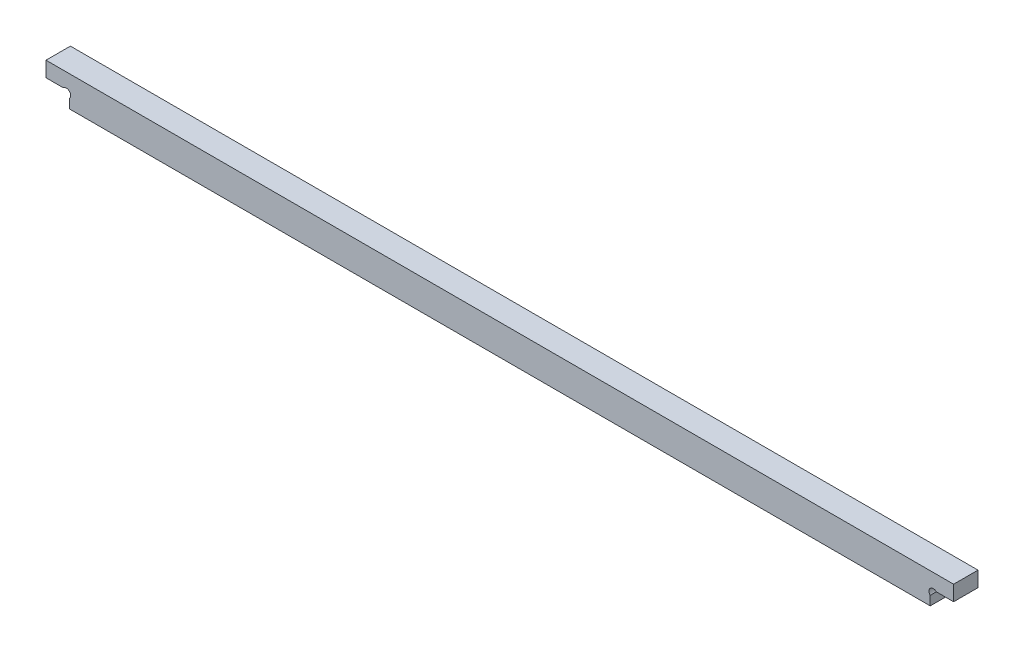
SolidWorks part; units mm, degrees
ref_plane "Спереди" through (0, 0, 0) normal (0, 0, 1) x (1, 0, 0)
ref_plane "Сверху" through (0, 0, 0) normal (0, 1, 0) x (1, 0, 0)
ref_plane "Справа" through (0, 0, 0) normal (1, 0, 0) x (0, 0, -1)
sketch "Эскиз1" plane through (0, 0, 0) normal (0, 0, 1) x (1, 0, 0)
  line L1 (-446.5, 15) -> (446.5, 15)
  line L2 (-446.5, 15) -> (-446.5, -15)
  line L3 (-446.5, -15) -> (446.5, -15)
  line L4 (446.5, 15) -> (446.5, -15)
  line L5 (0, -15) -> (0, 15) construction
  dimension "D1" = 30
  dimension "D2" = 893
extrude "Бобышка-Вытянуть1" add sketch "Эскиз1" along normal blind 24
sketch "Эскиз2" plane through (0, 0, 24) normal (0, 0, 1) x (1, 0, 0)
  line L5 (0, 15) -> (0, -15) construction
  line L6 (-446.5, 15) -> (-446.5, -15) construction
  line L7 (-446.5, -15) -> (-423.5, -15)
  line L8 (-446.5, -15) -> (-446.5, 0)
  line L9 (-446.5, 0) -> (-429.5104, 0)
  line L10 (-423.5, -15) -> (-423.5, -6.0104)
  line L11 (446.5, 15) -> (-446.5, 15) construction
  line L12 (-446.5, -15) -> (446.5, -15) construction
  line L13 (423.5, -15) -> (423.5, -6.0104)
  line L14 (446.5, 0) -> (429.5104, 0)
  line L15 (446.5, -15) -> (446.5, 0)
  line L16 (446.5, -15) -> (423.5, -15)
  arc A2 (-423.5, -6.0104) -> (-429.5104, 0) centre (-426.5, -3) ccw
  arc A3 (423.5, -6.0104) -> (429.5104, 0) centre (426.5, -3) cw
  dimension "D6" = 8.5
  dimension "D5" = 23
  dimension "D7" = 3
  dimension "D8" = 3
extrude "Вырез-Вытянуть1" cut sketch "Эскиз2" against normal through all
